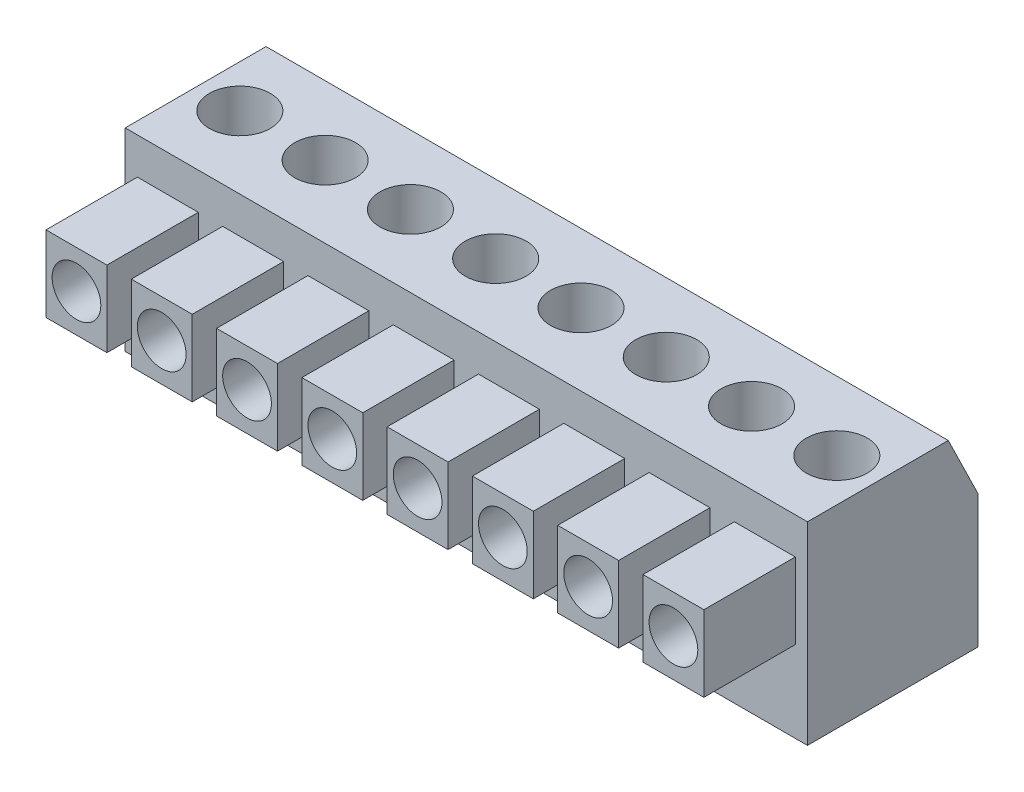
SolidWorks part; units mm, degrees
ref_plane "Ebene vorne" through (0, 0, 0) normal (0, 0, 1) x (1, 0, 0)
ref_plane "Ebene oben" through (0, 0, 0) normal (0, 1, 0) x (1, 0, 0)
ref_plane "Ebene rechts" through (0, 0, 0) normal (1, 0, 0) x (0, 0, -1)
sketch "Skizze1" plane through (0, 0, 0) normal (1, 0, 0) x (0, 0, -1)
  line L1 (-0.7, -0.7949) -> (0.7, -0.7949)
  line L2 (-0.7, -0.7949) -> (-0.7, 0.7949)
  line L3 (-0.7, 0.7949) -> (0.7, 0.7949)
  line L4 (0.7, -0.7949) -> (0.7, 0.7949)
  line L5 (0, 0.7949) -> (0, -0.7949) construction
  line L6 (-0.7, 0) -> (0.7, 0) construction
  point P0 (0, 0)
extrude "Aufsatz-Linear austragen1" add sketch "Skizze1" along normal blind 0.7
sketch "Skizze2" plane through (0, 0, -0.7) normal (0, 0, -1) x (-1, 0, 0)
  line L0 (55, 0) -> (-55, 0) construction
  line L1 (-0.6, 0) -> (-0.1, 0)
  line L2 (-0.6, 0) -> (-0.6, -0.6949)
  line L3 (-0.6, -0.6949) -> (-0.1, -0.6949)
  line L4 (-0.1, 0) -> (-0.1, -0.6949)
  line L5 (-0.35, -0.6949) -> (-0.35, 0) construction
  line L6 (-0.6, -0.3475) -> (-0.1, -0.3475) construction
  line L7 (-0.7, -0.7949) -> (0, -0.7949) construction
  line L8 (-0.7, -0.7949) -> (-0.7, 0.7949) construction
  line L9 (0, -0.7949) -> (0, 0.7949) construction
  point P0 (-0.35, -0.3475)
  dimension "D1" = 0.1
  dimension "D2" = 0.1
  dimension "D3" = 0.1
extrude "Schnitt-Linear austragen1" cut sketch "Skizze2" against normal blind 1
sketch "Skizze3" plane through (0, 0.7949, 0) normal (0, 1, 0) x (1, 0, 0)
  circle A0 centre (0.35, -0.1088) radius 0.25
extrude "Schnitt-Linear austragen2" cut sketch "Skizze3" against normal up to surface (0.7949 mm away)
sketch "Skizze4" plane through (0, 0, 0.7) normal (0, 0, 1) x (1, 0, 0)
  line L0 (0.7, 0.7949) -> (0.7, -0.7949) construction
  line L1 (0.1, 0.4949) -> (0.6, 0.4949)
  line L2 (0.1, 0.4949) -> (0.1, -0.1282)
  line L3 (0.1, -0.1282) -> (0.6, -0.1282)
  line L4 (0.6, 0.4949) -> (0.6, -0.1282)
  line L5 (0.35, -0.1282) -> (0.35, 0.4949) construction
  line L6 (0.1, 0.1834) -> (0.6, 0.1834) construction
  line L7 (0, 0.7949) -> (0, -0.7949) construction
  line L8 (0.7, 0.7949) -> (0, 0.7949) construction
  point P0 (0.35, 0.1834)
  dimension "D1" = 0.1
  dimension "D2" = 0.1
  dimension "D3" = 0.3
extrude "Aufsatz-Linear austragen2" add sketch "Skizze4" along normal blind 0.75
sketch "Skizze5" plane through (0, 0, 1.45) normal (0, 0, 1) x (1, 0, 0)
  line L2 (0.35, 0.4949) -> (0.35, -0.1282) construction
  line L3 (0.6, 0.4949) -> (0.1, 0.4949) construction
  line L4 (0.1, -0.1282) -> (0.6, -0.1282) construction
  line L5 (0.1, 0.1834) -> (0.6, 0.1834) construction
  line L6 (0.1, 0.4949) -> (0.1, -0.1282) construction
  line L7 (0.6, -0.1282) -> (0.6, 0.4949) construction
  circle A0 centre (0.35, 0.1834) radius 0.2
extrude "Schnitt-Linear austragen3" cut sketch "Skizze5" against normal up to surface (1.1499 mm away)
pattern_linear "Lineares Muster2" count 8 spacing 0.7 along (-1, 0, 0) of "Aufsatz-Linear austragen1", "Schnitt-Linear austragen1", "Schnitt-Linear austragen2", "Aufsatz-Linear austragen2", "Schnitt-Linear austragen3"
chamfer "Fase2" distance 0.5 angle 26 1 edges at (-2.1, 0.7949, -0.7)
scale "Skalieren1" scale about centroid uniform scaling yes scale factor 5.556
